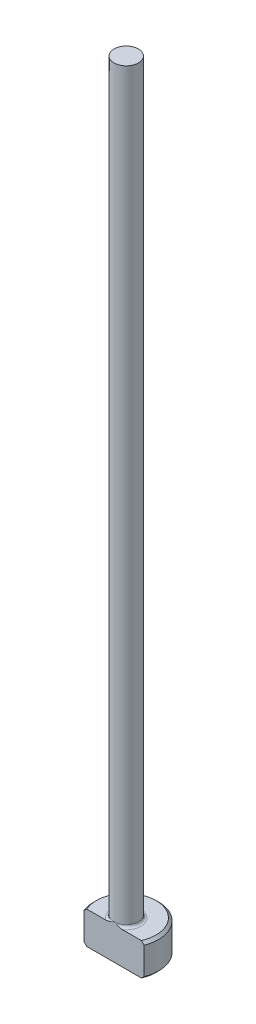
SolidWorks part; units mm, degrees
ref_plane "Front Plane" through (0, 0, 0) normal (0, 0, 1) x (1, 0, 0)
ref_plane "Top Plane" through (0, 0, 0) normal (0, 1, 0) x (1, 0, 0)
ref_plane "Right Plane" through (0, 0, 0) normal (1, 0, 0) x (0, 0, -1)
sketch "Sketch1" plane through (0, 0, 0) normal (0, 0, 1) x (1, 0, 0)
  line L0 (0, 259.9588) -> (0, -15.1925) construction
  line L1 (0, 0) -> (-3.175, 0)
  line L2 (-3.175, 0) -> (-3.175, 3.175)
  line L3 (-3.175, 3.175) -> (-1.19, 3.175)
  line L4 (-1.19, 3.175) -> (-1.19, 76.2)
  line L5 (-1.19, 76.2) -> (0, 76.2)
  line L6 (0, 76.2) -> (0, 0)
  dimension "L" = 76.2
  dimension "H" = 6.35
  dimension "T" = 3.175
  dimension "D" = 2.38
revolve "Revolve1" add sketch "Sketch1" angle 360 about L0
chamfer "Chamfer1" distance 0.254 angle 45 2 edges at (0, 3.175, 3.175) (0, 0, 3.175)
fillet "Fillet1" radius 0.254 1 edges at (0, 3.175, 1.19)
sketch "Sketch2" plane through (0, 0, 0) normal (0, 1, 0) x (1, 0, 0)
  line L0 (-2.9436, -1.19) -> (2.9436, -1.19)
  circle A0 centre (0, 0) radius 3.175 construction
  arc A1 (-2.9436, -1.19) -> (2.9436, -1.19) centre (0, 0) ccw
  circle A3 centre (0, 0) radius 1.19 construction
  dimension "D1" = 0
extrude "Key" cut sketch "Sketch2" along normal through all
sketch "Pocket Sketch" plane through (0, 0, 0) normal (0, 0, 1) x (1, 0, 0)
  line L0 (-3.5719, 0) -> (-3.5719, 3.2004)
  line L1 (-3.5719, 3.2004) -> (-2.1504, 3.2004)
  line L2 (-1.3884, 3.9624) -> (-1.3884, 22.225)
  line L3 (-1.3884, 22.225) -> (0, 22.225)
  line L4 (0, 22.225) -> (0, 0)
  line L5 (0, 0) -> (-3.5719, 0)
  line L6 (0, 12.6104) -> (0, -2.4989) construction
  line L7 (-3.175, 2.921) -> (-3.175, 0.254) construction
  line L8 (2.921, 3.175) -> (-2.921, 3.175) construction
  line L9 (-1.19, 76.2) -> (-1.19, 3.429) construction
  line L10 (-2.1504, 3.2004) -> (-1.3884, 3.9624)
  point P3 (-1.3884, 3.2004)
  dimension "D1" = 7.1437
  dimension "D2" = 0.3969
  dimension "D3" = 0.0254
  dimension "D4" = 0.1984
  dimension "D5" = 2.7769
  dimension "D6" = 22.225
